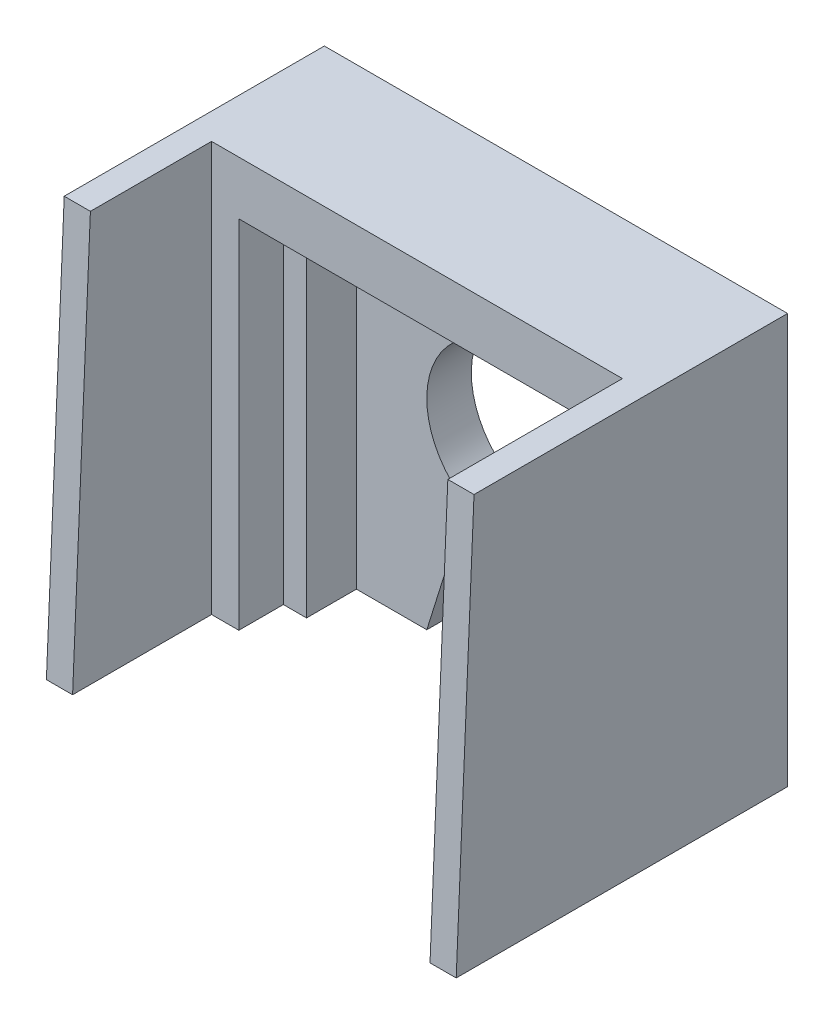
SolidWorks part; units mm, degrees
ref_plane "Front Plane" through (0, 0, 0) normal (0, 0, 1) x (1, 0, 0)
ref_plane "Top Plane" through (0, 0, 0) normal (0, 1, 0) x (1, 0, 0)
ref_plane "Right Plane" through (0, 0, 0) normal (1, 0, 0) x (0, 0, -1)
sketch "Sketch1" plane through (0, 0, 0) normal (0, 0, 1) x (1, 0, 0)
  line L0 (-10, 8.75) -> (10, 8.75)
  line L1 (0, 0) -> (0, 4.75) construction
  line L2 (-4.75, 0) -> (4.75, 0) construction
  line L3 (-10, 8.75) -> (-10, -11.25)
  line L4 (-10, -11.25) -> (-4.75, -11.25)
  line L5 (-4.75, -11.25) -> (-2.5, -4.0389)
  line L6 (10, 8.75) -> (10, -11.25)
  line L7 (10, -11.25) -> (4.75, -11.25)
  line L8 (4.75, -11.25) -> (2.5, -4.0389)
  arc A0 (2.5, -4.0389) -> (-2.5, -4.0389) centre (0, 0) ccw
  point P6 (0, 8.75)
  dimension "D1" = 4.75
  dimension "D3" = 4
  dimension "D2" = 5
  dimension "D4" = 20
  dimension "D5" = 20
extrude "Extrude1" add sketch "Sketch1" along normal blind 2.5
sketch "Sketch2" plane through (0, 0, 0) normal (0, 0, 1) x (1, 0, 0)
  line L0 (10, -11.25) -> (10, 8.75) construction
  line L1 (10, 8.75) -> (-10, 8.75) construction
  line L2 (-10, 8.75) -> (-10, -11.25) construction
  line L3 (10, -11.25) -> (10, 8.75)
  line L4 (10, 8.75) -> (-10, 8.75)
  line L5 (-10, 8.75) -> (-10, -11.25)
  line L6 (-10, -11.25) -> (-13, -11.25)
  line L7 (-13, -11.25) -> (-13, 11.75)
  line L8 (-13, 11.75) -> (13, 11.75)
  line L9 (13, 11.75) -> (13, -11.25)
  line L10 (13, -11.25) -> (10, -11.25)
  dimension "D1" = 3
  dimension "D2" = 3
extrude "Extrude2" add sketch "Sketch2" along normal blind 7.8
sketch "Sketch3" plane through (0, 0, 2.5) normal (0, 0, 1) x (1, 0, 0)
  line L0 (10, 8.75) -> (-10, 8.75) construction
  line L1 (-10, -11.25) -> (-8.7, -11.25)
  line L2 (-10, -11.25) -> (-10, 8.75)
  line L3 (-10, 8.75) -> (-8.7, 8.75)
  line L4 (-8.7, -11.25) -> (-8.7, 8.75)
  line L5 (4.75, -11.25) -> (10, -11.25) construction
  line L6 (10, 8.75) -> (8.7, 8.75)
  line L7 (10, 8.75) -> (10, -11.25)
  line L8 (10, -11.25) -> (8.7, -11.25)
  line L9 (8.7, 8.75) -> (8.7, -11.25)
  dimension "D1" = 1.3
extrude "Extrude3" add sketch "Sketch3" along normal blind 2.8
sketch "Sketch4" plane through (0, 0, 7.8) normal (0, 0, 1) x (1, 0, 0)
  line L0 (-13, -11.25) -> (-10, -11.25) construction
  line L1 (-13, 11.75) -> (-11.53, 11.75)
  line L2 (-13, 11.75) -> (-13, -11.25)
  line L3 (-13, -11.25) -> (-11.53, -11.25)
  line L4 (-11.53, 11.75) -> (-11.53, -11.25)
  line L6 (13, 11.75) -> (11.53, 11.75)
  line L7 (13, 11.75) -> (13, -11.25)
  line L8 (13, -11.25) -> (11.53, -11.25)
  line L9 (11.53, 11.75) -> (11.53, -11.25)
  dimension "D1" = 1.47
extrude "Extrude4" add sketch "Sketch4" along normal blind 10.8
sketch "Sketch5" plane through (13, 0, 0) normal (1, 0, 0) x (0, 0, -1)
  line L0 (-18.6, -11.25) -> (-18.6, 11.75) construction
  line L1 (-18.6, -11.25) -> (-18.6, 11.75)
  line L2 (-18.6, -11.25) -> (-17.6, 11.75)
  line L3 (-18.6, 11.75) -> (0, 11.75) construction
  line L4 (-17.6, 11.75) -> (-18.6, 11.75)
  dimension "D1" = 1
extrude "Cut-Extrude1" cut sketch "Sketch5" against normal up to surface (1.47 mm away)
sketch "Sketch6" plane through (-13, 0, 0) normal (-1, 0, 0) x (0, 0, 1)
  line L0 (18.6, 11.75) -> (18.6, -11.25) construction
  line L1 (18.6, 11.75) -> (18.6, -11.25)
  line L2 (18.6, 11.75) -> (14.6, 11.75)
  line L3 (18.6, 11.75) -> (0, 11.75) construction
  line L4 (14.6, 11.75) -> (15.6, -11.25)
  line L5 (18.6, -11.25) -> (0, -11.25) construction
  line L6 (15.6, -11.25) -> (18.6, -11.25)
  dimension "D1" = 4
  dimension "D2" = 3
extrude "Cut-Extrude2" cut sketch "Sketch6" against normal up to surface (1.47 mm away)
